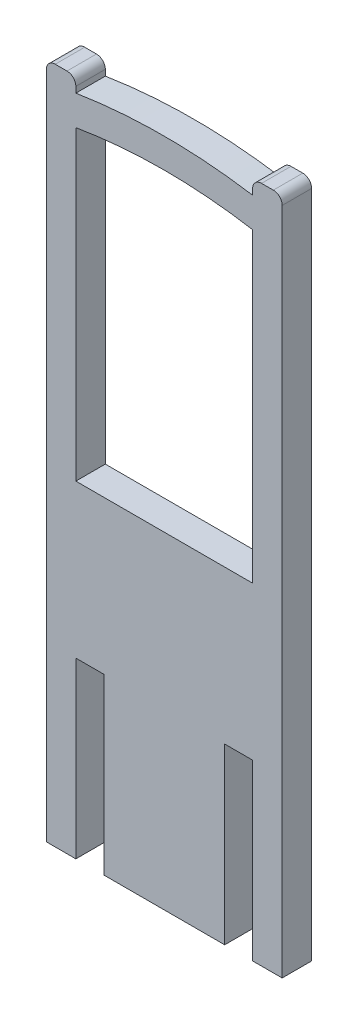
SolidWorks part; units mm, degrees
ref_plane "Plan de face" through (0, 0, 0) normal (0, 0, 1) x (1, 0, 0)
ref_plane "Plan de dessus" through (0, 0, 0) normal (0, 1, 0) x (1, 0, 0)
ref_plane "Plan de droite" through (0, 0, 0) normal (1, 0, 0) x (0, 0, -1)
sketch "Esquisse2" plane through (0, 0, 0) normal (0, 0, 1) x (1, 0, 0)
  line L0 (33, 239) -> (37, 239)
  line L1 (-30, 9) -> (-40, 9)
  line L2 (-30, 236) -> (-30, 234)
  line L3 (-30, 9) -> (-30, 68)
  line L4 (-30, 68) -> (-20.5, 68)
  line L5 (-20.5, 68) -> (-20.5, 9)
  line L6 (-40, 9) -> (-40, 236)
  line L7 (-33, 239) -> (-37, 239)
  line L8 (30, 120) -> (30, 30) construction
  line L10 (30, 223.8658) -> (30, 120)
  line L11 (-30, 120) -> (30, 120)
  line L12 (0, 0) -> (0, 120) construction
  line L13 (-30, 223.8658) -> (-30, 120)
  line L14 (30, 40) -> (30, 120) construction
  line L15 (40, 9) -> (40, 236)
  line L16 (30, 65) -> (21, 65) construction
  line L18 (20.5, 68) -> (20.5, 9)
  line L19 (30, 68) -> (20.5, 68)
  line L21 (30, 9) -> (30, 68)
  line L26 (30, 236) -> (30, 234)
  line L27 (20.5, 9) -> (-20.5, 9)
  line L28 (30, 9) -> (40, 9)
  arc A0 (30, 223.8658) -> (-30, 223.8658) centre (0, 46.3834) ccw
  arc A1 (30, 234) -> (-30, 234) centre (0, 46.3834) ccw
  arc A2 (28.4211, 224.1254) -> (-28.4211, 224.1254) centre (0, 46.3834) ccw construction
  arc A3 (-40, 236) -> (-37, 239) centre (-37, 236) cw
  arc A4 (-30, 236) -> (-33, 239) centre (-33, 236) ccw
  arc A5 (33, 239) -> (30, 236) centre (33, 236) ccw
  arc A6 (40, 236) -> (37, 239) centre (37, 236) ccw
  point P4 (0, 9)
  point P14 (30, 234)
  point P30 (-40, 239)
  point P33 (0, 47.5)
  point P35 (-30, 239)
  point P38 (30, 239)
  point P41 (40, 239)
  point P45 (30, 120)
  point P47 (-30, 120)
  dimension "D3" = 5
  dimension "D4" = 230
  dimension "D6" = 3
  dimension "D2" = 10
  dimension "D5" = 190
  dimension "D1" = 9
  dimension "D7" = 9.5
  dimension "D8" = 10
  dimension "D9" = 3
extrude "Boss.-Extru.1" add sketch "Esquisse2" along normal blind 10
